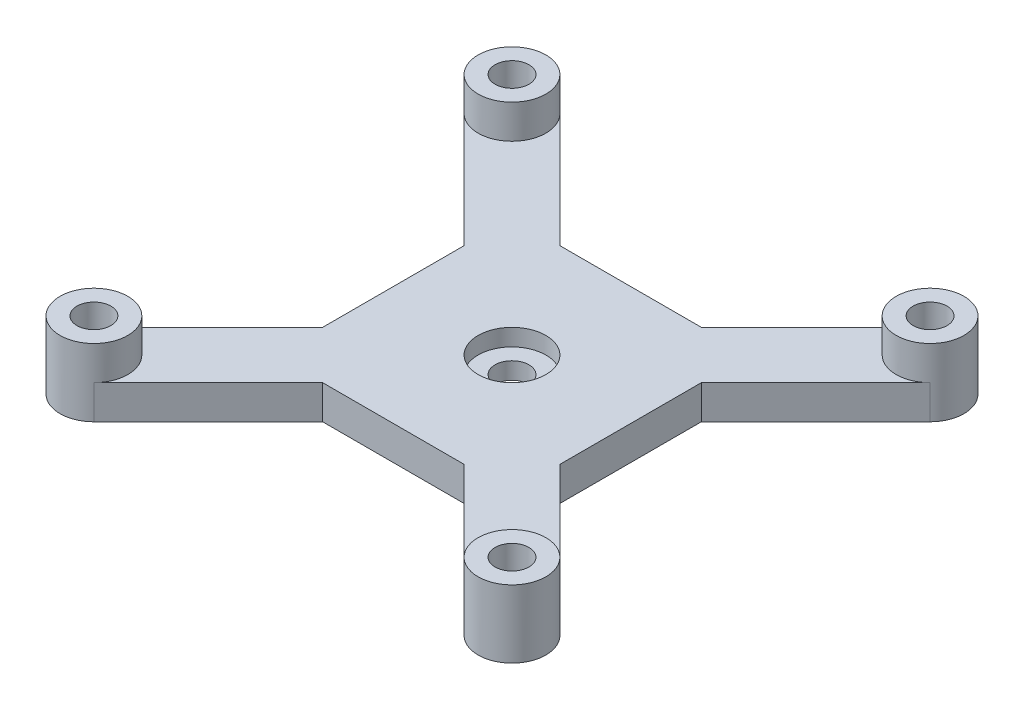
SolidWorks part; units mm, degrees
ref_plane "Plano frontal" through (0, 0, 0) normal (0, 0, 1) x (1, 0, 0)
ref_plane "Plano superior" through (0, 0, 0) normal (0, 1, 0) x (1, 0, 0)
ref_plane "Plano direito" through (0, 0, 0) normal (1, 0, 0) x (0, 0, -1)
sketch "Esboço1" plane through (0, 0, 0) normal (0, 1, 0) x (1, 0, 0)
  line L0 (-30.0205, 7.8967) -> (-19.8991, -2.2247)
  line L5 (-25.7778, 12.1393) -> (-15.6565, 2.018)
  line L6 (-25.7778, -29.1033) -> (-15.6565, -18.982)
  line L7 (-30.0205, -24.8607) -> (-19.8991, -14.7394)
  line L8 (-19.8991, -2.2247) -> (-19.8991, -14.7394)
  line L9 (-15.6565, -18.982) -> (-3.1418, -18.982)
  line L10 (1.1009, -2.2247) -> (1.1009, -14.7394)
  line L11 (-15.6565, 2.018) -> (-3.1418, 2.018)
  line L14 (-3.1418, -18.982) -> (6.9795, -29.1033)
  line L15 (1.1009, -14.7394) -> (11.2222, -24.8607)
  line L16 (1.1009, -2.2247) -> (11.2222, 7.8967)
  line L17 (-3.1418, 2.018) -> (6.9795, 12.1393)
  circle A0 centre (-27.8991, 10.018) radius 1.5
  circle A1 centre (9.1009, 10.018) radius 1.5
  circle A2 centre (9.1009, -26.982) radius 1.5
  circle A3 centre (-27.8991, -26.982) radius 1.5
  arc A4 (-25.7778, 12.1393) -> (-30.0205, 7.8967) centre (-27.8991, 10.018) ccw
  arc A5 (11.2222, 7.8967) -> (6.9795, 12.1393) centre (9.1009, 10.018) ccw
  arc A6 (6.9795, -29.1033) -> (11.2222, -24.8607) centre (9.1009, -26.982) ccw
  arc A7 (-30.0205, -24.8607) -> (-25.7778, -29.1033) centre (-27.8991, -26.982) ccw
  circle A8 centre (-9.3991, -8.482) radius 1.5
  point P24 (-9.3991, 2.018)
  point P25 (1.1009, -8.482)
  point P26 (-9.3991, -8.482)
  dimension "D3" = 3
  dimension "D4" = 6
  dimension "D6" = 3
  dimension "D1" = 37
  dimension "D2" = 37
extrude "Ressalto-extrusão1" add sketch "Esboço1" along normal blind 3
sketch "Esboço2" plane through (0, 3, 0) normal (0, 1, 0) x (1, 0, 0)
  circle A0 centre (-9.3991, -8.482) radius 1.5
  circle A1 centre (-9.3991, -8.482) radius 3
  dimension "D1" = 6
extrude "Corte-extrusão1" cut sketch "Esboço2" against normal blind 1.5
sketch "Esboço3" plane through (0, 3, 0) normal (0, 1, 0) x (1, 0, 0)
  circle A0 centre (-27.8991, 10.018) radius 1.5
  circle A1 centre (-27.8991, 10.018) radius 3
  circle A2 centre (9.1009, 10.018) radius 1.5
  circle A3 centre (9.1009, 10.018) radius 3
  circle A4 centre (9.1009, -26.982) radius 1.5
  circle A5 centre (9.1009, -26.982) radius 3
  circle A6 centre (-27.8991, -26.982) radius 1.5
  circle A7 centre (-27.8991, -26.982) radius 3
extrude "Ressalto-extrusão2" add sketch "Esboço3" along normal blind 3
